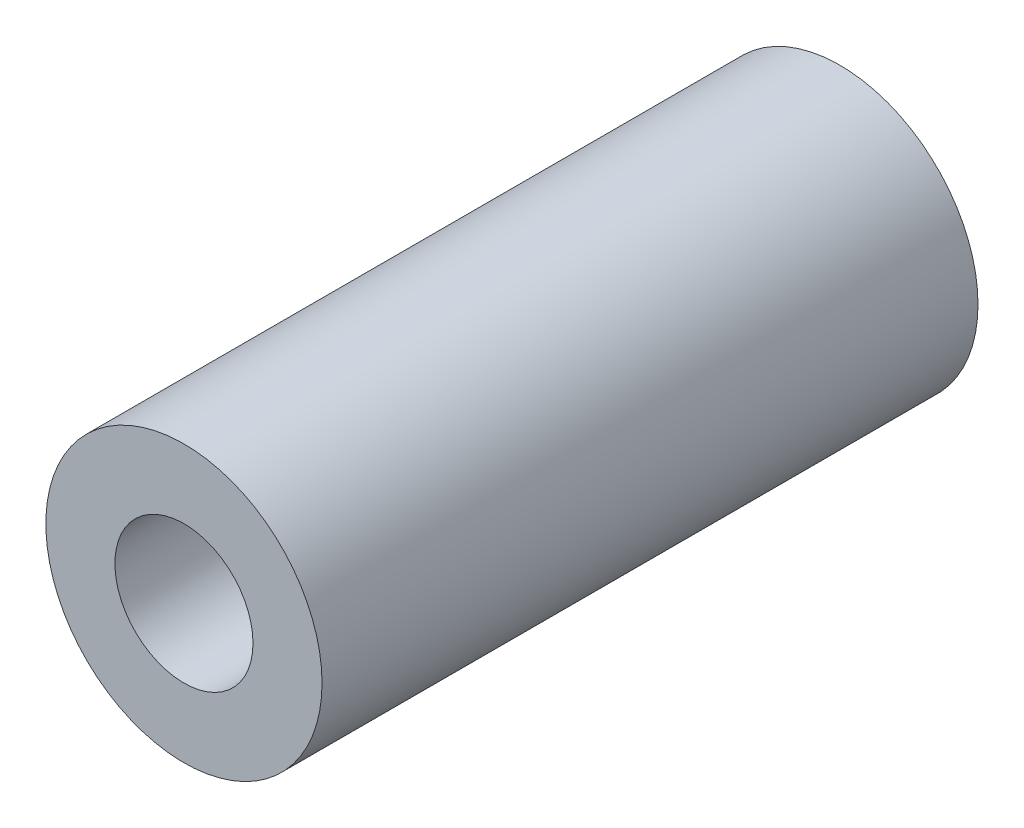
SolidWorks part; units mm, degrees
ref_plane "Спереди" through (0, 0, 0) normal (0, 0, 1) x (1, 0, 0)
ref_plane "Сверху" through (0, 0, 0) normal (0, 1, 0) x (1, 0, 0)
ref_plane "Справа" through (0, 0, 0) normal (1, 0, 0) x (0, 0, -1)
sketch "Эскиз1" plane through (0, 0, 0) normal (0, 0, 1) x (1, 0, 0)
  circle A0 centre (0, 0) radius 1
  circle A1 centre (0, 0) radius 2
  dimension "D1" = 2
  dimension "D2" = 4
extrude "Бобышка-Вытянуть1" add sketch "Эскиз1" along normal blind 9.5
